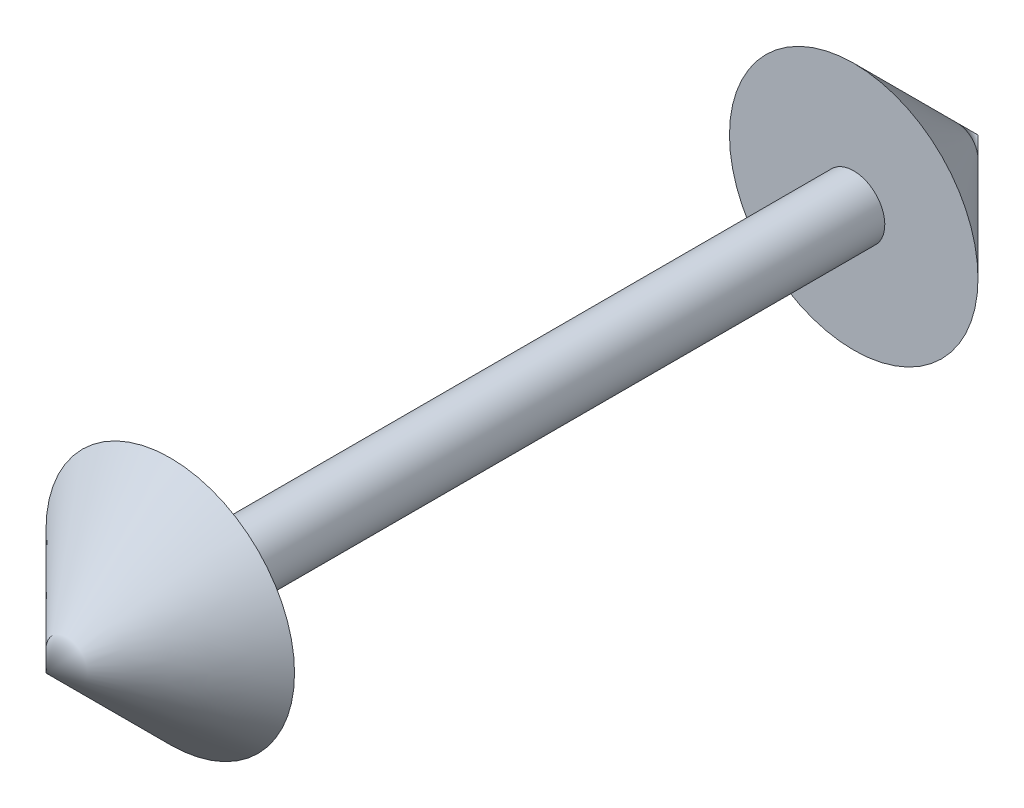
SolidWorks part; units mm, degrees
ref_plane "Plan de face" through (0, 0, 0) normal (0, 0, 1) x (1, 0, 0)
ref_plane "Plan de dessus" through (0, 0, 0) normal (0, 1, 0) x (1, 0, 0)
ref_plane "Plan de droite" through (0, 0, 0) normal (1, 0, 0) x (0, 0, -1)
sketch "Esquisse1" plane through (0, 0, 0) normal (0, 0, 1) x (1, 0, 0)
  circle A0 centre (0, 0) radius 10
  dimension "D1" = 20
extrude "Extrusion1" add sketch "Esquisse1" along normal blind 110
sketch "Esquisse14" plane through (0, 0, 0) normal (1, 0, 0) x (0, 0, -1)
  line L0 (0, 0) -> (0, 40)
  line L2 (0, 40) -> (40, 0)
  line L3 (40, 0) -> (0, 0)
  dimension "D1" = 40
  dimension "D2" = 40
revolve "Révolution1" add sketch "Esquisse14" angle 360 about L3
mirror "Symétrie1" about plane through (0, 0, 110) normal (0, 0, 1) of "Révolution1", "Extrusion1"
sketch "Esquisse15" plane through (0, 0, 0) normal (0, 1, 0) x (1, 0, 0)
  point P0 (0, 40)
  point P1 (0, -260)
